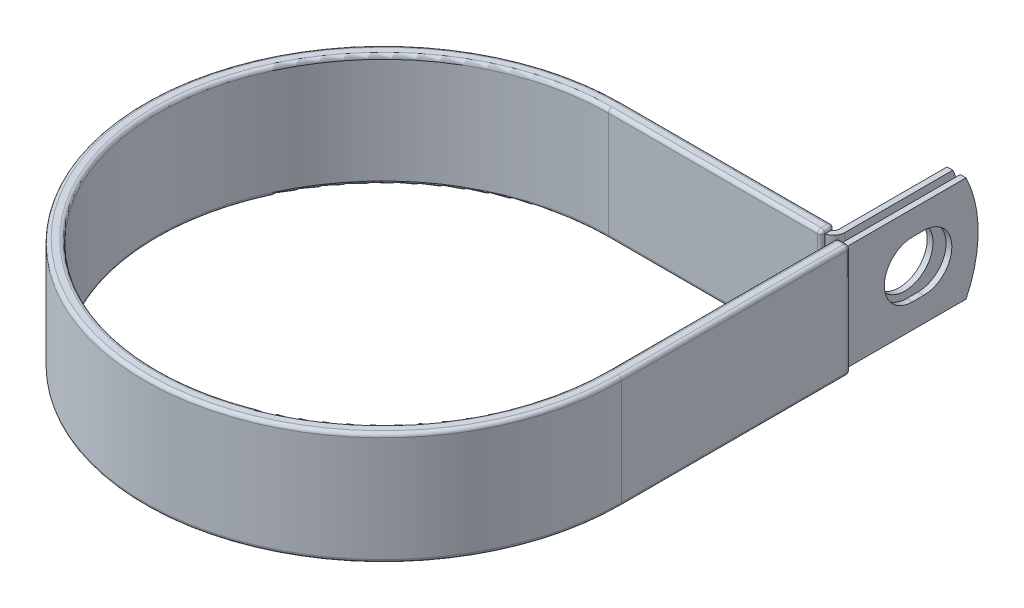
SolidWorks part; units mm, degrees
ref_plane "Front Plane" through (0, 0, 0) normal (0, 0, 1) x (1, 0, 0)
ref_plane "Top Plane" through (0, 0, 0) normal (0, 1, 0) x (1, 0, 0)
ref_plane "Right Plane" through (0, 0, 0) normal (1, 0, 0) x (0, 0, -1)
sketch "Sketch1" plane through (0, 0, 0) normal (0, 1, 0) x (1, 0, 0)
  line L0 (0, 48.4187) -> (44.4665, 48.4187)
  line L1 (48.4187, 0) -> (48.4187, 48.4187)
  line L2 (46.8439, 76.2) -> (46.8439, 50.7962)
  line L5 (48.4187, 48.4187) -> (48.4187, 76.2)
  arc A0 (0, 48.4187) -> (48.4187, 0) centre (0, 0) ccw
  arc A3 (44.4665, 48.4187) -> (46.8439, 50.7962) centre (44.4665, 50.7962) ccw
extrude "Extrude-Thin1" add sketch "Sketch1" along normal mid plane 22.225 thin
sketch "Sketch2" plane through (45.6247, 0, 0) normal (-1, 0, 0) x (0, 0, 1)
  line L0 (-76.2, 11.1125) -> (-76.2, -11.1125) construction
  line L7 (0, 11.1125) -> (0, -11.1125) construction
  circle A0 centre (-63.5, 0) radius 5.9436
  point P2 (-76.2, 0)
extrude "Cut-Extrude1" cut sketch "Sketch2" against normal up to surface (1.2192 mm away)
sketch "Sketch3" plane through (49.6379, 0, 0) normal (1, 0, 0) x (0, 0, -1)
  line L0 (62.3062, 0) -> (64.6938, 0) construction
  line L1 (62.3062, 5.9436) -> (64.6938, 5.9436)
  line L2 (62.3062, -5.9436) -> (64.6938, -5.9436)
  line L3 (76.2, 11.1125) -> (76.2, -11.1125) construction
  arc A0 (62.3062, 5.9436) -> (62.3062, -5.9436) centre (62.3062, 0) ccw
  arc A1 (64.6938, -5.9436) -> (64.6938, 5.9436) centre (64.6938, 0) ccw
  point P3 (63.5, 0)
  point P8 (76.2, 0)
  point P11 (56.3626, 0)
  point P12 (70.6374, 0)
extrude "Cut-Extrude2" cut sketch "Sketch3" against normal up to surface (1.2192 mm away)
sketch "Sketch4" plane through (45.6247, 0, 0) normal (-1, 0, 0) x (0, 0, 1)
  line L0 (-76.2, 11.1125) -> (-76.2, -11.1125)
  line L1 (-76.2, 11.1125) -> (-73.6401, 11.1125)
  line L2 (-76.2, 11.1125) -> (-50.7962, 11.1125) construction
  line L3 (-76.2, -11.1125) -> (-73.6401, -11.1125)
  line L4 (-76.2, -11.1125) -> (-50.7962, -11.1125) construction
  arc A0 (-73.6401, 11.1125) -> (-73.6401, -11.1125) centre (-50.8, 0) ccw
extrude "Cut-Extrude3" cut sketch "Sketch4" against normal through all contours A0 M4 M5 | A0 L0 M2
ref_plane "Plane1" through (0, 0, -48.4187) normal (0, 0, 1) x (1, 0, 0)
ref_plane "Plane2" through (0, 0, 0) normal (-1, 0, 0) x (0, 0, 1)
sketch "Sketch5" plane through (0, 0, -48.4187) normal (0, 0, 1) x (1, 0, 0)
  line L0 (48.4187, 11.1125) -> (49.6379, 11.1125)
  line L1 (48.4187, -11.1125) -> (48.4187, 11.1125)
  line L2 (47.625, -11.1442) -> (47.625, 11.1442)
  line L3 (49.6379, 11.1125) -> (49.6379, -11.1125)
  line L4 (49.6379, -11.1125) -> (48.4187, -11.1125)
  line L5 (48.387, 11.9062) -> (49.6697, 11.9062)
  line L7 (50.4317, 11.1442) -> (50.4317, -11.1442)
  line L8 (49.6697, -11.9062) -> (48.387, -11.9062)
  line L9 (47.625, -11.9062) -> (47.625, 11.9062) construction
  line L11 (50.4317, -11.9062) -> (47.625, -11.9062) construction
  line L12 (50.4317, 11.9062) -> (50.4317, -11.9062) construction
  line L13 (47.625, 11.9062) -> (50.4317, 11.9062) construction
  arc A0 (47.625, -11.1442) -> (48.387, -11.9062) centre (48.387, -11.1442) ccw
  arc A1 (50.4317, -11.1442) -> (49.6697, -11.9062) centre (49.6697, -11.1442) cw
  arc A2 (47.625, 11.1442) -> (48.387, 11.9062) centre (48.387, 11.1442) cw
  arc A3 (49.6697, 11.9062) -> (50.4317, 11.1442) centre (49.6697, 11.1442) cw
sketch "Sketch6" plane through (0, 11.1125, 0) normal (0, 1, 0) x (1, 0, 0)
  line L0 (47.625, 0) -> (47.625, 48.4187)
  line L1 (0, 47.625) -> (44.9898, 47.625)
  line L2 (45.6247, 73.6401) -> (45.6247, 50.7962) construction
  arc A0 (0, 47.625) -> (47.625, 0) centre (0, 0) ccw
sweep "Sweep1" add profiles "Sketch5" path "Sketch6"
fillet "Fillet1" radius 0.762 16 edges at (44.9898, 11.6831, -50.2085) (44.9898, 0, -50.4317) (44.9898, -11.6831, -50.2085) (44.9898, -11.9062, -49.0283) (44.9898, -11.6831, -47.8482) (44.9898, 0, -47.625) (44.9898, 11.6831, -47.8482) (50.2085, 11.6831, -48.4187) (50.4317, 0, -48.4187) (50.2085, -11.6831, -48.4187) (49.0283, -11.9062, -48.4187) (47.8482, -11.6831, -48.4187) (47.625, 0, -48.4187) (47.8482, 11.6831, -48.4187) (44.9898, 11.9062, -49.0283) (49.0283, 11.9062, -48.4187)
equation "\"D4@Sketch5\" = \"D1@Extrude-Thin1\""
equation "\"D5@Sketch5\" = \"D5@Extrude-Thin1\""
equation "\"D1@Sketch3\" = \"D2@Sketch2\""
equation "\"D7@Sketch1\" = \"D3@Sketch2\" + \"D1@Sketch3\""
equation "\"D1@Sketch1\" = \"D1@Sketch6\" + 2 * \"D3@Sketch5\""
equation "\"D1@Sketch4\" = ( \"D1@Extrude-Thin1\" + .125 ) * 2"
equation "\"D2@Sketch1\"=1.95*\"D5@Extrude-Thin1\""
equation "\"D2@Sketch3\" = \"D1@Sketch2\""
